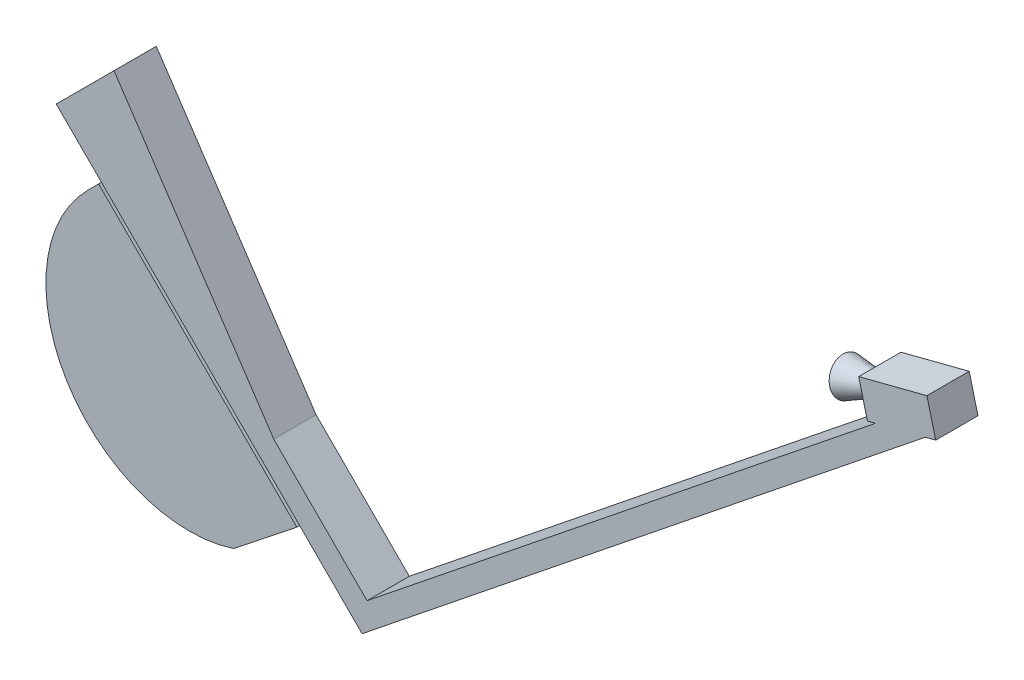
SolidWorks part; units mm, degrees
ref_plane "Front Plane" through (0, 0, 0) normal (0, 0, 1) x (1, 0, 0)
ref_plane "Top Plane" through (0, 0, 0) normal (0, 1, 0) x (1, 0, 0)
ref_plane "Right Plane" through (0, 0, 0) normal (1, 0, 0) x (0, 0, -1)
sketch "Sketch1" plane through (0, 0, 0) normal (0, 0, 1) x (1, 0, 0)
  line L0 (0, 0) -> (168.0485, -168.0485)
  line L2 (168.0485, -168.0485) -> (1084.2081, 566.8383)
  line L3 (1084.2081, 566.8383) -> (1069.7837, 563.1159)
  line L4 (1069.7837, 563.1159) -> (1053.9164, 624.6015)
  line L5 (1053.9164, 624.6015) -> (1176.8877, 656.336)
  line L6 (1176.8877, 656.336) -> (1192.7549, 594.8504)
  line L7 (1192.7549, 594.8504) -> (1173.9803, 590.0054)
  line L8 (1173.9803, 590.0054) -> (159.1363, -224.04)
  line L10 (159.1363, -224.04) -> (-391.927, 327.0234)
  line L11 (-391.927, 327.0234) -> (-287.8498, 431.1006)
  line L12 (-287.8498, 431.1006) -> (0, 0)
  dimension "D1" = 38.1
  dimension "D2" = 127
  dimension "D3" = 63.5
extrude "Boss-Extrude1" add sketch "Sketch1" along normal mid plane 76.2
sketch "Sketch2" plane through (0, 0, 0) normal (0, 0, 1) x (1, 0, 0)
  line L0 (1058.2851, 607.6731) -> (987.5832, 607.6731)
  line L1 (1053.9164, 624.6015) -> (1069.7837, 563.1159) construction
  line L2 (987.5832, 607.6731) -> (995.5627, 576.7523)
  line L3 (995.5627, 576.7523) -> (1061.8501, 593.8587)
  line L4 (1061.8501, 593.8587) -> (1058.2851, 607.6731)
  point P9 (1061.8501, 593.8587)
revolve "Revolve1" add sketch "Sketch2" angle 360 about L3
sketch "Sketch3" plane through (0, 0, 38.1) normal (0, 0, 1) x (1, 0, 0)
  line L0 (-310.477, 245.5734) -> (-329.9653, 226.0851)
  line L1 (-391.927, 327.0234) -> (159.1363, -224.04) construction
  line L2 (-67.2523, -201.8326) -> (46.6386, -111.5423)
  line L3 (-310.477, 245.5734) -> (46.6386, -111.5423)
  arc A0 (-329.9653, 226.0851) -> (-67.2523, -201.8326) centre (-147.428, 43.5479) ccw
extrude "Boss-Extrude2" add sketch "Sketch3" along normal blind 5 separate body
sketch "Sketch4" plane through (0, 0, 43.1) normal (0, 0, 1) x (1, 0, 0)
  arc A0 (-326.4452, 165.0258) -> (-268.906, -135.4694) centre (-147.428, 43.5479) ccw construction
  arc A1 (-331.6997, 168.5914) -> (-272.4715, -140.7238) centre (-147.428, 43.5479) ccw
  arc A2 (-321.1908, 161.4603) -> (-265.3404, -130.2149) centre (-147.428, 43.5479) ccw
  arc A3 (-321.1908, 161.4603) -> (-331.6997, 168.5914) centre (-326.4452, 165.0258) ccw
  arc A4 (-272.4715, -140.7238) -> (-265.3404, -130.2149) centre (-268.906, -135.4694) ccw
  arc A5 (-329.9653, 226.0851) -> (-67.2523, -201.8326) centre (-147.428, 43.5479) ccw construction
  point P3 (-359.9102, 2.8614)
  point P11 (0, 0)
  dimension "D3" = 216.3425
  dimension "D1" = 12.7
  dimension "D2" = 90
